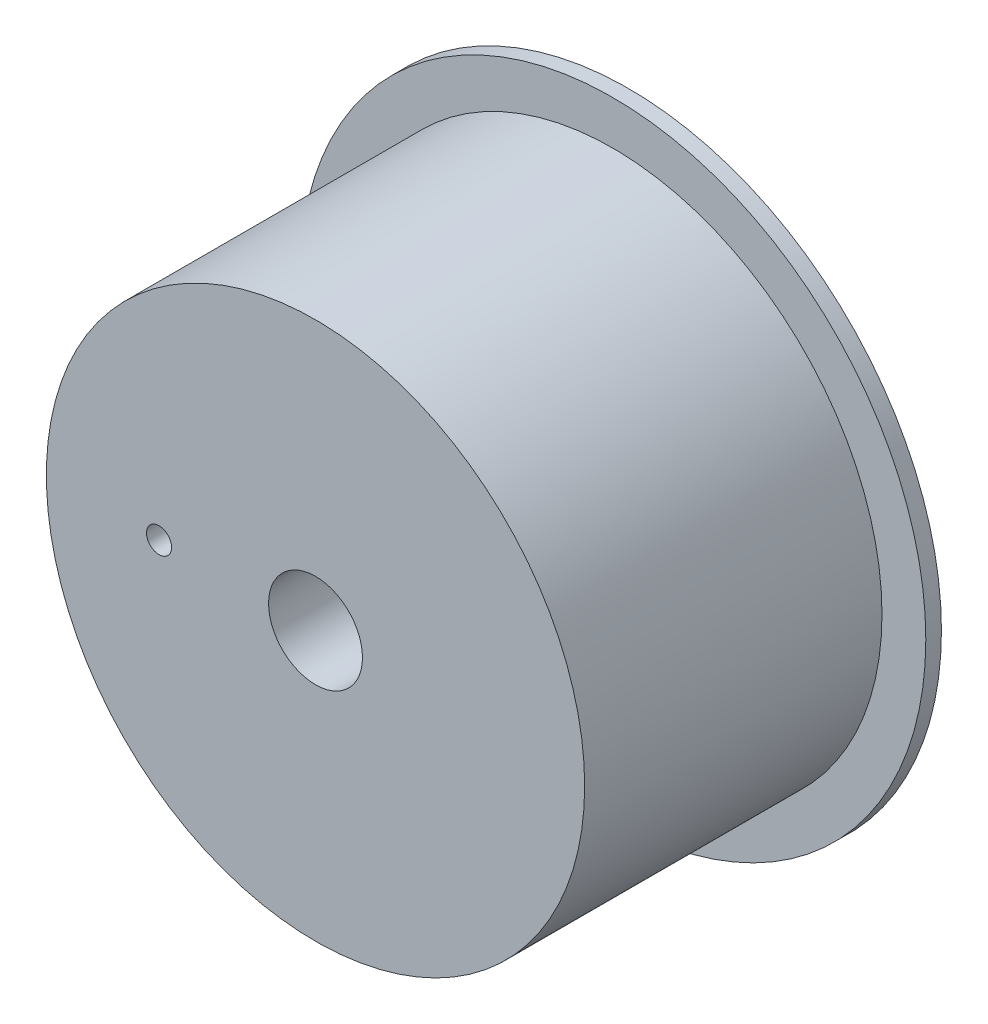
SolidWorks part; units mm, degrees
ref_plane "Front" through (0, 0, 0) normal (0, 0, 1) x (1, 0, 0)
ref_plane "Top" through (0, 0, 0) normal (0, 1, 0) x (1, 0, 0)
ref_plane "Right" through (0, 0, 0) normal (1, 0, 0) x (0, 0, -1)
sketch "Esquisse1" plane through (0, 0, 0) normal (0, 0, 1) x (1, 0, 0)
  circle A0 centre (0, 0) radius 10
  dimension "D1" = 20
extrude "Boss.-Extru.1" add sketch "Esquisse1" along normal blind 0.5
sketch "Esquisse2" plane through (0, 0, 0.5) normal (0, 0, 1) x (1, 0, 0)
  circle A0 centre (0, 0) radius 8.6
  dimension "D1" = 17.2
extrude "Boss.-Extru.2" add sketch "Esquisse2" along normal blind 9.5
sketch "Esquisse3" plane through (0, 0, 0) normal (0, 0, -1) x (-1, 0, 0)
  circle A0 centre (0, 0) radius 8
  circle A1 centre (0, 0) radius 3
  dimension "D1" = 16
  dimension "D2" = 6
extrude "Enlèv. mat.-Extru.1" cut sketch "Esquisse3" against normal blind 6
hole_wizard "Diamètre du perçage Ø0.15 (0.15)1" positions "Esquisse5" profile "Esquisse4" hole size "Ø0.15" standard "Ansi Metric"
sketch "Esquisse5" plane through (0, 0, 0) normal (0, 0, -1) x (-1, 0, 0)
  point P0 (0, 0)
sketch "Esquisse4" plane through (0, 0, 0) normal (1, 0, 0) x (0, 1, 0)
  line L0 (0, 0) -> (0, 10)
  line L1 (0, 10) -> (1.5, 10)
  line L2 (1.5, 10) -> (1.5, 0)
  line L5 (1.5, 0) -> (0, 0)
  line L11 (0, -6.35) -> (0, 107.95) construction
  dimension "Diamètre du perçage jusqu'au prochain" = 3
  dimension "Profondeur du perçage jusqu'au prochain" = 10
hole_wizard "Diamètre du perçage Ø0.15 (0.15)2" positions "Esquisse7" profile "Esquisse6" hole size "Ø0.15" standard "Ansi Metric"
sketch "Esquisse7" plane through (0, 0, 6) normal (0, 0, -1) x (-1, 0, 0)
  point P0 (5, 0)
  dimension "D1" = 5
sketch "Esquisse6" plane through (-5, 0, 6) normal (1, 0, 0) x (0, 1, 0)
  line L0 (0, 0) -> (0, 4)
  line L1 (0, 4) -> (0.4, 4)
  line L2 (0.4, 4) -> (0.4, 0)
  line L5 (0.4, 0) -> (0, 0)
  line L11 (0, -6.35) -> (0, 107.95) construction
  dimension "Diamètre du perçage jusqu'au prochain" = 0.8
  dimension "Profondeur du perçage jusqu'au prochain" = 4
